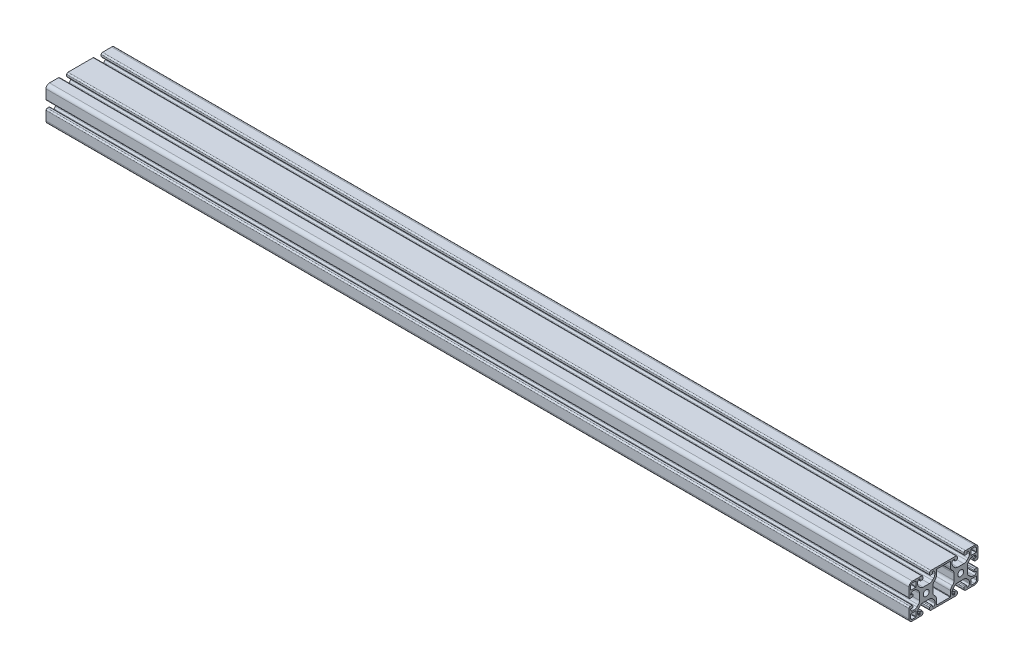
SolidWorks part; units mm, degrees
ref_plane "Ebene vorne" through (0, 0, 0) normal (0, 0, 1) x (1, 0, 0)
ref_plane "Ebene oben" through (0, 0, 0) normal (0, 1, 0) x (1, 0, 0)
ref_plane "Ebene rechts" through (0, 0, 0) normal (1, 0, 0) x (0, 0, -1)
sketch "Skizze2" plane through (0, 0, 0) normal (0, 1, 0) x (1, 0, 0)
  line L0 (0, 0) -> (1000, 0)
  dimension "D1" = 1000
other "Strukturbauteil1"
ref_plane "Ebene1" through (0, 0, 0) normal (1, 0, 0) x (0, 0, -1)
sketch "Model" plane through (0, 0, 0) normal (1, 0, 0) x (0, 0, -1)
  line L0 (-38.2, 16) -> (-38.2, 12.3)
  line L1 (-37.7, 11.8) -> (-32.3, 11.8)
  line L2 (-31.8, 12.3) -> (-31.8, 17.7)
  line L3 (-32.3, 18.2) -> (-36, 18.2)
  line L4 (-36, -18.2) -> (-32.3, -18.2)
  line L5 (-31.8, -17.7) -> (-31.8, -12.3)
  line L6 (-32.3, -11.8) -> (-37.7, -11.8)
  line L7 (-38.2, -12.3) -> (-38.2, -16)
  line L8 (-40, -16) -> (-40, -5.5)
  line L9 (-38.5, -4) -> (-36.5, -4)
  line L10 (-35.5, -5) -> (-35.5, -6.5)
  line L11 (-36, -7) -> (-37.5, -7)
  line L12 (-35.5, -10) -> (-34.1924, -10)
  line L13 (-30.6569, -8.5355) -> (-29.2145, -7.0931)
  line L14 (-27.75, -3.5576) -> (-27.75, 3.5576)
  line L15 (-29.2145, 7.0931) -> (-30.6569, 8.5355)
  line L16 (-34.1924, 10) -> (-35.5, 10)
  line L17 (-37.5, 7) -> (-36, 7)
  line L18 (-35.5, 6.5) -> (-35.5, 5)
  line L19 (-36.5, 4) -> (-38.5, 4)
  line L20 (-40, 5.5) -> (-40, 16)
  line L21 (-36, 20) -> (-25.5, 20)
  line L22 (-24, 18.5) -> (-24, 16.5)
  line L23 (-25, 15.5) -> (-26.5, 15.5)
  line L24 (-27, 16) -> (-27, 17.5)
  line L25 (-30, 15.5) -> (-30, 14.1924)
  line L26 (-28.5355, 10.6569) -> (-27.0931, 9.2145)
  line L27 (-23.5576, 7.75) -> (-16.4424, 7.75)
  line L28 (-12.9069, 9.2145) -> (-11.4645, 10.6569)
  line L29 (-10, 14.1924) -> (-10, 15.5)
  line L30 (-13, 17.5) -> (-13, 16)
  line L31 (-13.5, 15.5) -> (-15, 15.5)
  line L32 (-16, 16.5) -> (-16, 18.5)
  line L33 (-14.5, 20) -> (14.5, 20)
  line L34 (16, 18.5) -> (16, 16.5)
  line L35 (15, 15.5) -> (13.5, 15.5)
  line L36 (13, 16) -> (13, 17.5)
  line L37 (10, 15.5) -> (10, 14.1924)
  line L38 (11.4645, 10.6569) -> (12.9069, 9.2145)
  line L39 (16.4424, 7.75) -> (23.5576, 7.75)
  line L40 (27.0931, 9.2145) -> (28.5355, 10.6569)
  line L41 (30, 14.1924) -> (30, 15.5)
  line L42 (27, 17.5) -> (27, 16)
  line L43 (26.5, 15.5) -> (25, 15.5)
  line L44 (24, 16.5) -> (24, 18.5)
  line L45 (25.5, 20) -> (36, 20)
  line L46 (40, 16) -> (40, 5.5)
  line L47 (38.5, 4) -> (36.5, 4)
  line L48 (35.5, 5) -> (35.5, 6.5)
  line L49 (36, 7) -> (37.5, 7)
  line L50 (35.5, 10) -> (34.1924, 10)
  line L51 (30.6569, 8.5355) -> (29.2145, 7.0931)
  line L52 (27.75, 3.5576) -> (27.75, -3.5576)
  line L53 (29.2145, -7.0931) -> (30.6569, -8.5355)
  line L54 (34.1924, -10) -> (35.5, -10)
  line L55 (37.5, -7) -> (36, -7)
  line L56 (35.5, -6.5) -> (35.5, -5)
  line L57 (36.5, -4) -> (38.5, -4)
  line L58 (40, -5.5) -> (40, -16)
  line L59 (36, -20) -> (25.5, -20)
  line L60 (24, -18.5) -> (24, -16.5)
  line L61 (25, -15.5) -> (26.5, -15.5)
  line L62 (27, -16) -> (27, -17.5)
  line L63 (30, -15.5) -> (30, -14.1924)
  line L64 (28.5355, -10.6569) -> (27.0931, -9.2145)
  line L65 (23.5576, -7.75) -> (16.4424, -7.75)
  line L66 (12.9069, -9.2145) -> (11.4645, -10.6569)
  line L67 (10, -14.1924) -> (10, -15.5)
  line L68 (13, -17.5) -> (13, -16)
  line L69 (13.5, -15.5) -> (15, -15.5)
  line L70 (16, -16.5) -> (16, -18.5)
  line L71 (14.5, -20) -> (-14.5, -20)
  line L72 (-16, -18.5) -> (-16, -16.5)
  line L73 (-15, -15.5) -> (-13.5, -15.5)
  line L74 (-13, -16) -> (-13, -17.5)
  line L75 (-10, -15.5) -> (-10, -14.1924)
  line L76 (-11.4645, -10.6569) -> (-12.9069, -9.2145)
  line L77 (-16.4424, -7.75) -> (-23.5576, -7.75)
  line L78 (-27.0931, -9.2145) -> (-28.5355, -10.6569)
  line L79 (-30, -14.1924) -> (-30, -15.5)
  line L80 (-27, -17.5) -> (-27, -16)
  line L81 (-26.5, -15.5) -> (-25, -15.5)
  line L82 (-24, -16.5) -> (-24, -18.5)
  line L83 (-25.5, -20) -> (-36, -20)
  line L84 (38.2, 12.3) -> (38.2, 16)
  line L85 (36, 18.2) -> (32.3, 18.2)
  line L86 (31.8, 17.7) -> (31.8, 12.3)
  line L87 (32.3, 11.8) -> (37.7, 11.8)
  line L88 (38.2, -16) -> (38.2, -12.3)
  line L89 (37.7, -11.8) -> (32.3, -11.8)
  line L90 (31.8, -12.3) -> (31.8, -17.7)
  line L91 (32.3, -18.2) -> (36, -18.2)
  line L92 (-12.25, 3.5576) -> (-12.25, -3.5576)
  line L93 (-8.2, -11.5949) -> (-8.2, -17.5)
  line L94 (-7.7, -18) -> (7.7, -18)
  line L95 (8.2, -17.5) -> (8.2, -11.5949)
  line L96 (12.25, -3.5576) -> (12.25, 3.5576)
  line L97 (8.2, 11.5949) -> (8.2, 17.5)
  line L98 (7.7, 18) -> (-7.7, 18)
  line L99 (-8.2, 17.5) -> (-8.2, 11.5949)
  line L100 (-10.1805, 7.6096) -> (-10.2695, 7.5429)
  line L101 (-40, 20) -> (40.0055, 20) construction
  line L102 (-40, 20) -> (-40, -20) construction
  line L103 (-40, -20) -> (40.0055, -20) construction
  line L104 (40.0055, 20) -> (40.0055, -20) construction
  line L105 (-40, 20) -> (40.0055, -20) construction
  line L106 (-40, -20) -> (40.0055, 20) construction
  line L109 (10.1805, 7.6096) -> (10.2695, 7.5429)
  line L110 (-10.2695, -7.5429) -> (-10.1805, -7.6096)
  line L111 (10.1805, -7.6096) -> (10.2695, -7.5429)
  line L112 (37.5, 7) -> (37.6913, 7.0381)
  line L113 (-12.5, -18) -> (-12.6913, -17.9619)
  line L114 (-27, -17.5) -> (-27.0381, -17.6913)
  line L115 (-27.0381, -17.6913) -> (-27.1464, -17.8536)
  line L116 (-12.6913, -17.9619) -> (-12.8536, -17.8536)
  line L117 (-27.3087, -17.9619) -> (-27.1464, -17.8536)
  line L118 (-27.5, -18) -> (-27.3087, -17.9619)
  line L119 (-12.9619, -17.6913) -> (-12.8536, -17.8536)
  line L120 (-13, -17.5) -> (-12.9619, -17.6913)
  line L121 (-27, 17.5) -> (-27.0381, 17.6913)
  line L122 (-27.0381, 17.6913) -> (-27.1464, 17.8536)
  line L123 (-27.3087, 17.9619) -> (-27.1464, 17.8536)
  line L124 (-27.5, 18) -> (-27.3087, 17.9619)
  line L125 (-13, 17.5) -> (-12.9619, 17.6913)
  line L126 (-12.9619, 17.6913) -> (-12.8536, 17.8536)
  line L127 (-12.6913, 17.9619) -> (-12.8536, 17.8536)
  line L128 (-12.5, 18) -> (-12.6913, 17.9619)
  line L129 (12.5, 18) -> (12.6913, 17.9619)
  line L130 (12.6913, 17.9619) -> (12.8536, 17.8536)
  line L131 (12.9619, 17.6913) -> (12.8536, 17.8536)
  line L132 (13, 17.5) -> (12.9619, 17.6913)
  line L133 (27, 17.5) -> (27.0381, 17.6913)
  line L134 (27.0381, 17.6913) -> (27.1464, 17.8536)
  line L135 (27.3087, 17.9619) -> (27.1464, 17.8536)
  line L136 (27.5, 18) -> (27.3087, 17.9619)
  line L137 (27, -17.5) -> (27.0381, -17.6913)
  line L138 (27.0381, -17.6913) -> (27.1464, -17.8536)
  line L139 (27.3087, -17.9619) -> (27.1464, -17.8536)
  line L140 (27.5, -18) -> (27.3087, -17.9619)
  line L141 (13, -17.5) -> (12.9619, -17.6913)
  line L142 (12.9619, -17.6913) -> (12.8536, -17.8536)
  line L143 (12.6913, -17.9619) -> (12.8536, -17.8536)
  line L144 (12.5, -18) -> (12.6913, -17.9619)
  line L145 (37.6913, 7.0381) -> (37.8536, 7.1464)
  line L146 (-38, -7.5) -> (-37.9619, -7.3087)
  line L147 (-37.9619, -7.3087) -> (-37.8536, -7.1464)
  line L148 (-37.6913, -7.0381) -> (-37.8536, -7.1464)
  line L149 (-37.5, -7) -> (-37.6913, -7.0381)
  line L150 (-37.5, 7) -> (-37.6913, 7.0381)
  line L151 (-37.6913, 7.0381) -> (-37.8536, 7.1464)
  line L152 (-37.9619, 7.3087) -> (-37.8536, 7.1464)
  line L153 (-38, 7.5) -> (-37.9619, 7.3087)
  line L154 (37.9619, 7.3087) -> (37.8536, 7.1464)
  line L155 (38, 7.5) -> (37.9619, 7.3087)
  line L156 (37.5, -7) -> (37.6913, -7.0381)
  line L157 (37.6913, -7.0381) -> (37.8536, -7.1464)
  line L158 (37.9619, -7.3087) -> (37.8536, -7.1464)
  line L159 (38, -7.5) -> (37.9619, -7.3087)
  circle A0 centre (-20, 0) radius 3.4
  circle A1 centre (20, 0) radius 3.4
  arc A2 (-36, 18.2) -> (-38.2, 16) centre (-36, 16) ccw
  arc A3 (-38.2, 12.3) -> (-37.7, 11.8) centre (-37.7, 12.3) ccw
  arc A4 (-32.3, 11.8) -> (-31.8, 12.3) centre (-32.3, 12.3) ccw
  arc A5 (-31.8, 17.7) -> (-32.3, 18.2) centre (-32.3, 17.7) ccw
  arc A6 (-38.2, -16) -> (-36, -18.2) centre (-36, -16) ccw
  arc A7 (-32.3, -18.2) -> (-31.8, -17.7) centre (-32.3, -17.7) ccw
  arc A8 (-31.8, -12.3) -> (-32.3, -11.8) centre (-32.3, -12.3) ccw
  arc A9 (-37.7, -11.8) -> (-38.2, -12.3) centre (-37.7, -12.3) ccw
  arc A10 (-38.5, -4) -> (-40, -5.5) centre (-38.5, -5.5) ccw
  arc A11 (-35.5, -5) -> (-36.5, -4) centre (-36.5, -5) ccw
  arc A12 (-36, -7) -> (-35.5, -6.5) centre (-36, -6.5) ccw
  arc A14 (-38, -7.5) -> (-35.5, -10) centre (-35.5, -7.5) ccw
  arc A15 (-34.1924, -10) -> (-30.6569, -8.5355) centre (-34.1924, -5) ccw
  arc A16 (-29.2145, -7.0931) -> (-27.75, -3.5576) centre (-32.75, -3.5576) ccw
  arc A17 (-27.75, 3.5576) -> (-29.2145, 7.0931) centre (-32.75, 3.5576) ccw
  arc A18 (-30.6569, 8.5355) -> (-34.1924, 10) centre (-34.1924, 5) ccw
  arc A19 (-35.5, 10) -> (-38, 7.5) centre (-35.5, 7.5) ccw
  arc A21 (-35.5, 6.5) -> (-36, 7) centre (-36, 6.5) ccw
  arc A22 (-36.5, 4) -> (-35.5, 5) centre (-36.5, 5) ccw
  arc A23 (-40, 5.5) -> (-38.5, 4) centre (-38.5, 5.5) ccw
  arc A24 (-36, 20) -> (-40, 16) centre (-36, 16) ccw
  arc A25 (-24, 18.5) -> (-25.5, 20) centre (-25.5, 18.5) ccw
  arc A26 (-25, 15.5) -> (-24, 16.5) centre (-25, 16.5) ccw
  arc A27 (-27, 16) -> (-26.5, 15.5) centre (-26.5, 16) ccw
  arc A29 (-27.5, 18) -> (-30, 15.5) centre (-27.5, 15.5) ccw
  arc A30 (-30, 14.1924) -> (-28.5355, 10.6569) centre (-25, 14.1924) ccw
  arc A31 (-27.0931, 9.2145) -> (-23.5576, 7.75) centre (-23.5576, 12.75) ccw
  arc A32 (-16.4424, 7.75) -> (-12.9069, 9.2145) centre (-16.4424, 12.75) ccw
  arc A33 (-11.4645, 10.6569) -> (-10, 14.1924) centre (-15, 14.1924) ccw
  arc A34 (-10, 15.5) -> (-12.5, 18) centre (-12.5, 15.5) ccw
  arc A36 (-13.5, 15.5) -> (-13, 16) centre (-13.5, 16) ccw
  arc A37 (-16, 16.5) -> (-15, 15.5) centre (-15, 16.5) ccw
  arc A38 (-14.5, 20) -> (-16, 18.5) centre (-14.5, 18.5) ccw
  arc A39 (16, 18.5) -> (14.5, 20) centre (14.5, 18.5) ccw
  arc A40 (15, 15.5) -> (16, 16.5) centre (15, 16.5) ccw
  arc A41 (13, 16) -> (13.5, 15.5) centre (13.5, 16) ccw
  arc A43 (12.5, 18) -> (10, 15.5) centre (12.5, 15.5) ccw
  arc A44 (10, 14.1924) -> (11.4645, 10.6569) centre (15, 14.1924) ccw
  arc A45 (12.9069, 9.2145) -> (16.4424, 7.75) centre (16.4424, 12.75) ccw
  arc A46 (23.5576, 7.75) -> (27.0931, 9.2145) centre (23.5576, 12.75) ccw
  arc A47 (28.5355, 10.6569) -> (30, 14.1924) centre (25, 14.1924) ccw
  arc A48 (30, 15.5) -> (27.5, 18) centre (27.5, 15.5) ccw
  arc A50 (26.5, 15.5) -> (27, 16) centre (26.5, 16) ccw
  arc A51 (24, 16.5) -> (25, 15.5) centre (25, 16.5) ccw
  arc A52 (25.5, 20) -> (24, 18.5) centre (25.5, 18.5) ccw
  arc A53 (40, 16) -> (36, 20) centre (36, 16) ccw
  arc A54 (38.5, 4) -> (40, 5.5) centre (38.5, 5.5) ccw
  arc A55 (35.5, 5) -> (36.5, 4) centre (36.5, 5) ccw
  arc A56 (36, 7) -> (35.5, 6.5) centre (36, 6.5) ccw
  arc A58 (38, 7.5) -> (35.5, 10) centre (35.5, 7.5) ccw
  arc A59 (34.1924, 10) -> (30.6569, 8.5355) centre (34.1924, 5) ccw
  arc A60 (29.2145, 7.0931) -> (27.75, 3.5576) centre (32.75, 3.5576) ccw
  arc A61 (27.75, -3.5576) -> (29.2145, -7.0931) centre (32.75, -3.5576) ccw
  arc A62 (30.6569, -8.5355) -> (34.1924, -10) centre (34.1924, -5) ccw
  arc A63 (35.5, -10) -> (38, -7.5) centre (35.5, -7.5) ccw
  arc A65 (35.5, -6.5) -> (36, -7) centre (36, -6.5) ccw
  arc A66 (36.5, -4) -> (35.5, -5) centre (36.5, -5) ccw
  arc A67 (40, -5.5) -> (38.5, -4) centre (38.5, -5.5) ccw
  arc A68 (36, -20) -> (40, -16) centre (36, -16) ccw
  arc A69 (24, -18.5) -> (25.5, -20) centre (25.5, -18.5) ccw
  arc A70 (25, -15.5) -> (24, -16.5) centre (25, -16.5) ccw
  arc A71 (27, -16) -> (26.5, -15.5) centre (26.5, -16) ccw
  arc A73 (27.5, -18) -> (30, -15.5) centre (27.5, -15.5) ccw
  arc A74 (30, -14.1924) -> (28.5355, -10.6569) centre (25, -14.1924) ccw
  arc A75 (27.0931, -9.2145) -> (23.5576, -7.75) centre (23.5576, -12.75) ccw
  arc A76 (16.4424, -7.75) -> (12.9069, -9.2145) centre (16.4424, -12.75) ccw
  arc A77 (11.4645, -10.6569) -> (10, -14.1924) centre (15, -14.1924) ccw
  arc A78 (10, -15.5) -> (12.5, -18) centre (12.5, -15.5) ccw
  arc A80 (13.5, -15.5) -> (13, -16) centre (13.5, -16) ccw
  arc A81 (16, -16.5) -> (15, -15.5) centre (15, -16.5) ccw
  arc A82 (14.5, -20) -> (16, -18.5) centre (14.5, -18.5) ccw
  arc A83 (-16, -18.5) -> (-14.5, -20) centre (-14.5, -18.5) ccw
  arc A84 (-15, -15.5) -> (-16, -16.5) centre (-15, -16.5) ccw
  arc A85 (-13, -16) -> (-13.5, -15.5) centre (-13.5, -16) ccw
  arc A87 (-12.5, -18) -> (-10, -15.5) centre (-12.5, -15.5) ccw
  arc A88 (-10, -14.1924) -> (-11.4645, -10.6569) centre (-15, -14.1924) ccw
  arc A89 (-12.9069, -9.2145) -> (-16.4424, -7.75) centre (-16.4424, -12.75) ccw
  arc A90 (-23.5576, -7.75) -> (-27.0931, -9.2145) centre (-23.5576, -12.75) ccw
  arc A91 (-28.5355, -10.6569) -> (-30, -14.1924) centre (-25, -14.1924) ccw
  arc A92 (-30, -15.5) -> (-27.5, -18) centre (-27.5, -15.5) ccw
  arc A94 (-26.5, -15.5) -> (-27, -16) centre (-26.5, -16) ccw
  arc A95 (-24, -16.5) -> (-25, -15.5) centre (-25, -16.5) ccw
  arc A96 (-25.5, -20) -> (-24, -18.5) centre (-25.5, -18.5) ccw
  arc A97 (-40, -16) -> (-36, -20) centre (-36, -16) ccw
  arc A98 (37.7, 11.8) -> (38.2, 12.3) centre (37.7, 12.3) ccw
  arc A99 (38.2, 16) -> (36, 18.2) centre (36, 16) ccw
  arc A100 (32.3, 18.2) -> (31.8, 17.7) centre (32.3, 17.7) ccw
  arc A101 (31.8, 12.3) -> (32.3, 11.8) centre (32.3, 12.3) ccw
  arc A102 (38.2, -12.3) -> (37.7, -11.8) centre (37.7, -12.3) ccw
  arc A103 (32.3, -11.8) -> (31.8, -12.3) centre (32.3, -12.3) ccw
  arc A104 (31.8, -17.7) -> (32.3, -18.2) centre (32.3, -17.7) ccw
  arc A105 (36, -18.2) -> (38.2, -16) centre (36, -16) ccw
  arc A106 (-10.2695, 7.5429) -> (-12.25, 3.5576) centre (-7.25, 3.5576) ccw
  arc A107 (-12.25, -3.5576) -> (-10.2695, -7.5429) centre (-7.25, -3.5576) ccw
  arc A108 (-8.2, -11.5949) -> (-10.1805, -7.6096) centre (-13.2, -11.5949) ccw
  arc A109 (-8.2, -17.5) -> (-7.7, -18) centre (-7.7, -17.5) ccw
  arc A110 (7.7, -18) -> (8.2, -17.5) centre (7.7, -17.5) ccw
  arc A111 (10.1805, -7.6096) -> (8.2, -11.5949) centre (13.2, -11.5949) ccw
  arc A112 (10.2695, -7.5429) -> (12.25, -3.5576) centre (7.25, -3.5576) ccw
  arc A113 (12.25, 3.5576) -> (10.2695, 7.5429) centre (7.25, 3.5576) ccw
  arc A114 (8.2, 11.5949) -> (10.1805, 7.6096) centre (13.2, 11.5949) ccw
  arc A115 (8.2, 17.5) -> (7.7, 18) centre (7.7, 17.5) ccw
  arc A116 (-7.7, 18) -> (-8.2, 17.5) centre (-7.7, 17.5) ccw
  arc A117 (-10.1805, 7.6096) -> (-8.2, 11.5949) centre (-13.2, 11.5949) ccw
  point P37 (0, 0)
  point P301 (0, 20)
  point P332 (0.0028, 0)
  point P338 (-20, 20)
  point P339 (-40, 0)
  point P340 (0, -20)
  point P342 (-20, -20)
  point P343 (20, -20)
  point P344 (20, 20)
  point P345 (40.0055, 0)
